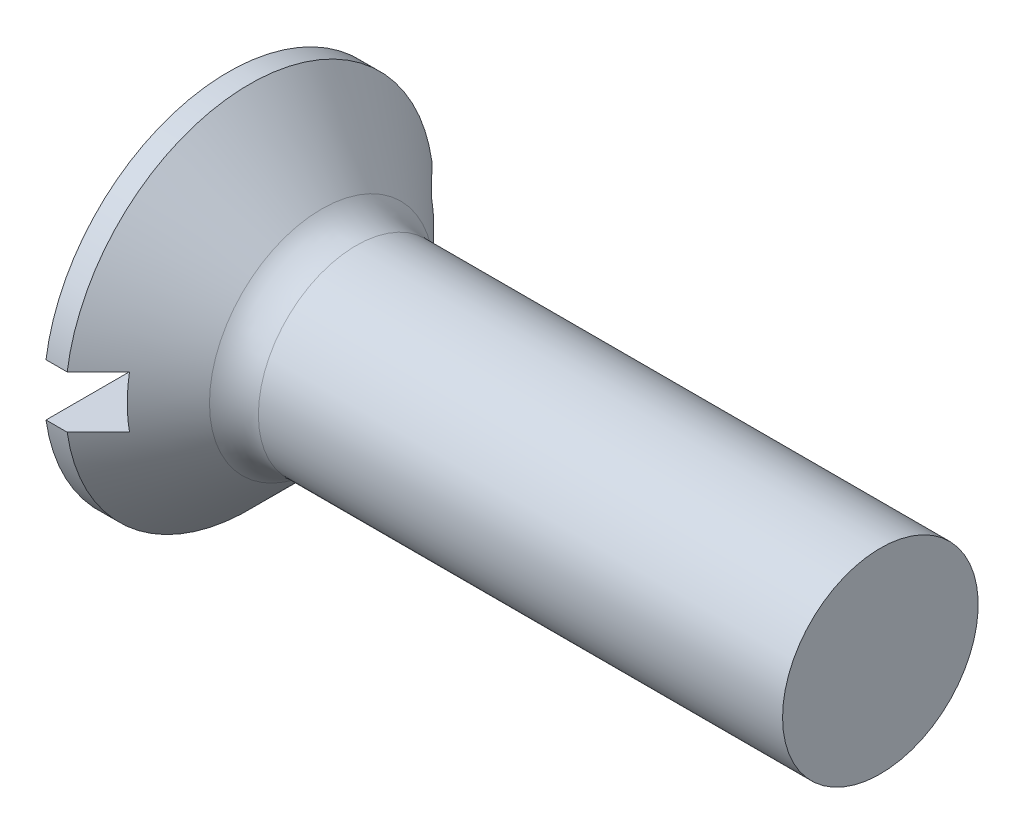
SolidWorks part; units mm, degrees
ref_plane "Plane1" through (0, 0, 0) normal (0, 0, 1) x (1, 0, 0)
ref_plane "Plane2" through (0, 0, 0) normal (0, 1, 0) x (1, 0, 0)
ref_plane "Plane3" through (0, 0, 0) normal (1, 0, 0) x (0, 0, -1)
sketch "BodySke" plane through (0, 0, 0) normal (0, 0, 1) x (1, 0, 0)
  line L0 (0, 0) -> (0, 5.65)
  line L1 (0, 5.65) -> (0.65, 5.65)
  line L2 (3.3, 3) -> (20, 3)
  line L3 (20, 3) -> (20, 0)
  line L4 (20, 0) -> (0, 0)
  line L5 (-6.35, 0) -> (82.55, 0) construction
  line L6 (3.3, -3) -> (20, -3) construction
  line L7 (0.65, -5.65) -> (3.3, -3) construction
  line L8 (0.65, 5.65) -> (3.3, 3)
  line L9 (0, -5.65) -> (0.65, -5.65) construction
  line L10 (4.3, 4.5875) -> (4.3, -4.9375) construction
  line L11 (0, 6.35) -> (0, -3.175) construction
  dimension "Diameter" = 6
  dimension "Length" = 20
  dimension "Head_ht" = 3.3
  dimension "Head_dia" = 11.3
  dimension "Head_ang" = 90
  dimension "D6" = 0.65
  dimension "Advance" = 1
  dimension "Thread_nom" = 20
revolve "Base-Revolve" add sketch "BodySke" angle 360 about L5
fillet "Fillet1" radius 1.5 1 edges at (3.3, 0, 3)
sketch "Sketch2" plane through (0, 0, 0) normal (-1, 0, 0) x (0, 0, 1)
  line L0 (-5.65, -0.8) -> (5.65, -0.8)
  line L1 (-5.65, -0.8) -> (-5.65, 0.8)
  line L2 (5.65, 0.8) -> (-5.65, 0.8)
  line L3 (5.65, 0.8) -> (5.65, -0.8)
  dimension "D1" = 0.8
  dimension "Slot_width" = 1.6
  dimension "D2" = 11.3
  dimension "D3" = 5.65
extrude "Slot" cut sketch "Sketch2" against normal blind 1.6
sketch "ThdSchSke" plane through (0, 0, 0) normal (0, 0, 1) x (1, 0, 0)
  line L0 (4.3, -2.4455) -> (3.9117, -3)
  line L1 (4.3, -2.4455) -> (4.6883, -3)
  line L2 (4.6883, -3) -> (4.6883, -3.75)
  line L3 (-3.175, 0) -> (5.1513, 0) construction
  line L5 (4.6883, -3.75) -> (3.9117, -3.75)
  line L6 (3.9117, -3.75) -> (3.9117, -3)
  line L7 (0, 5.65) -> (0, 0.8) construction
  dimension "Thread_minor" = 4.891
  dimension "Diameter" = 6
  dimension "Start" = 4.3
  dimension "SideAngle" = 55
  dimension "VeeAngle" = 70
  dimension "Overcut" = 7.5
revolve "ThreadSchematic" [suppressed] cut sketch "ThdSchSke" angle 360 about L3
pattern_linear "ThdSchPat" [suppressed]
equation "\"D1@Sketch2\" = \"Slot_width@Sketch2\" / 2"
equation "\"D2@Sketch2\" = \"Head_dia@BodySke\""
equation "\"D3@Sketch2\" = \"D2@Sketch2\" / 2"
equation "\"Thread_length@ThreadCosmetic\" = ((sgn( (\"Length@BodySke\" - \"Advance@BodySke\" * 1.0 - \"Head_ht@BodySke\" ) - \"Thread_nom@BodySke\" )-1)*( (\"Length@BodySke\" - \"Advance@BodySke\" * 1.0 - \"Head_ht@BodySke\" "
equation "\"Thread_minor@ThdSchSke\" = \"Thread_minor@ThreadCosmetic\""
equation "\"Diameter@ThdSchSke\" = \"Diameter@BodySke\""
equation "\"Overcut@ThdSchSke\" = \"Diameter@BodySke\" * 1.25"
equation "\"Start@ThdSchSke\" = 0.000001 + \"Length@BodySke\" - \"Thread_length@ThreadCosmetic\"  '---Countersunk---"
equation "\"Num_threads@ThdSchPat\" = int( \"Thread_length@ThreadCosmetic\" / \"Advance@BodySke\" + 0.999 )  + 1"
equation "\"Advance@ThdSchPat\" = \"Thread_length@ThreadCosmetic\" /  (\"Num_threads@ThdSchPat\" - 1) 'relax it"
